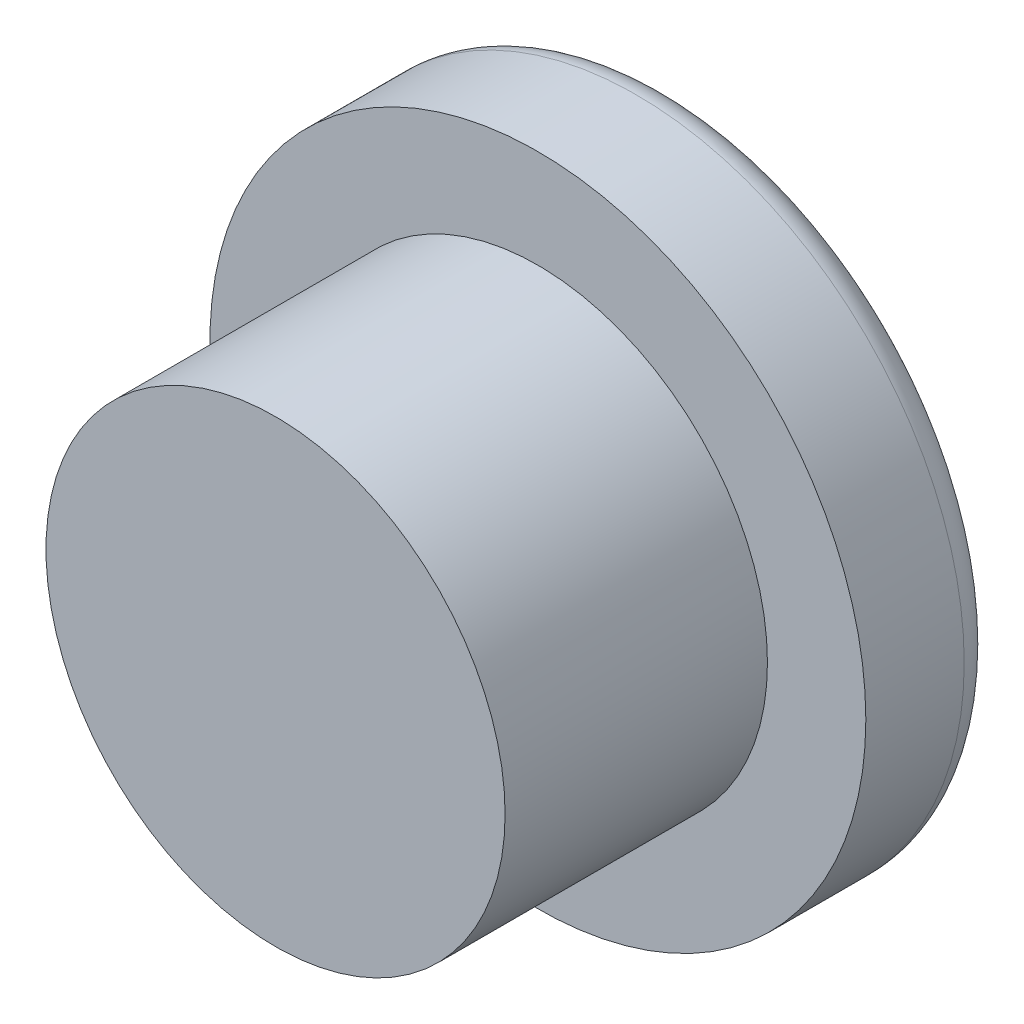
SolidWorks part; units mm, degrees
ref_plane "Plan de face" through (0, 0, 0) normal (0, 0, 1) x (1, 0, 0)
ref_plane "Plan de dessus" through (0, 0, 0) normal (0, 1, 0) x (1, 0, 0)
ref_plane "Plan de droite" through (0, 0, 0) normal (1, 0, 0) x (0, 0, -1)
sketch "Esquisse1" plane through (0, 0, 0) normal (0, 0, 1) x (1, 0, 0)
  circle A0 centre (0, 0) radius 5
  dimension "D1" = 10
extrude "Boss.-Extru.1" add sketch "Esquisse1" along normal blind 6
sketch "Esquisse2" plane through (0, 0, 6) normal (0, 0, 1) x (1, 0, 0)
  circle A0 centre (0, 0) radius 3.5
  dimension "D1" = 7
extrude "Enlèv. mat.-Extru.1" cut sketch "Esquisse2" against normal blind 4 flip side to cut
sketch "Esquisse3" plane through (0, 0, 0) normal (0, 0, -1) x (-1, 0, 0)
  circle A0 centre (0, 0) radius 3
  dimension "D1" = 6
extrude "Enlèv. mat.-Extru.2" cut sketch "Esquisse3" against normal blind 0.2
fillet "Congé1" radius 0.5 1 edges at (5, 0, 0)
sketch "Esquisse5" plane through (0, 0, 0.2) normal (0, 0, -1) x (-1, 0, 0)
  text T0 "5A" font "Arial" height 3.5
extrude "Boss.-Extru.2" add sketch "Esquisse5" along normal blind 0.2
